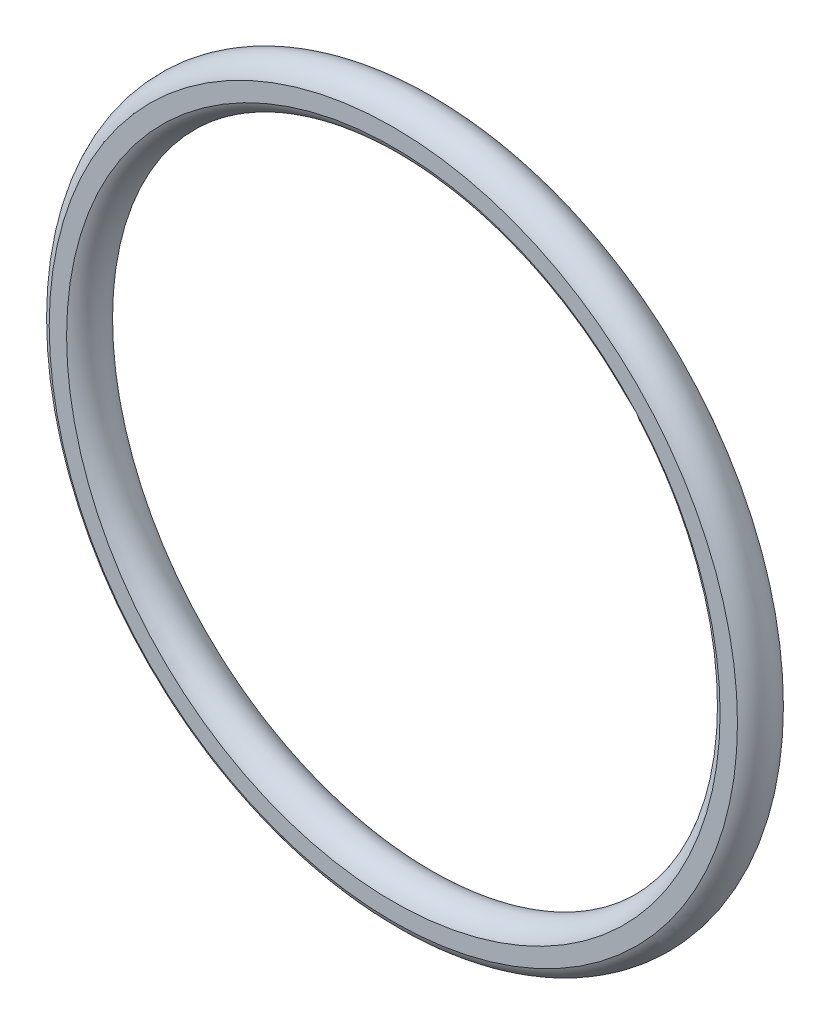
SolidWorks part; units mm, degrees
ref_plane "Front" through (0, 0, 0) normal (0, 0, 1) x (1, 0, 0)
ref_plane "Top" through (0, 0, 0) normal (0, 1, 0) x (1, 0, 0)
ref_plane "Right" through (0, 0, 0) normal (1, 0, 0) x (0, 0, -1)
sketch "Sketch1" plane through (0, 0, 0) normal (1, 0, 0) x (0, -1, 0)
  line L0 (0, -1.7653) -> (0, 1.7653) construction
  line L2 (-29.8539, 0) -> (29.8539, 0) construction
  line L3 (-23.6093, 0) -> (23.6093, 0) construction
  circle A0 centre (25.3746, 0) radius 1.7653
  point P9 (23.6093, 0)
  point P10 (27.1399, 0)
  point P13 (25.3746, 1.7653)
  point P14 (25.3746, -1.7653)
  dimension "Width" = 3.5306
  dimension "ID" = 47.2186
revolve "Revolve1" add sketch "Sketch1" angle 360 about L0
sketch "Sketch2" plane through (0, 0, 0) normal (0, 0, 1) x (1, 0, 0)
  point P0 (0, 0)
ref_plane "Plane1" through (0, 0, 1.7653) normal (0, 0, 1) x (1, 0, 0)
sketch "Sketch3" plane through (0, 0, 1.7653) normal (0, 0, 1) x (1, 0, 0)
  circle A0 centre (0, 0) radius 31.5702
extrude "Cut-Extrude1" cut sketch "Sketch3" against normal blind 0.127
